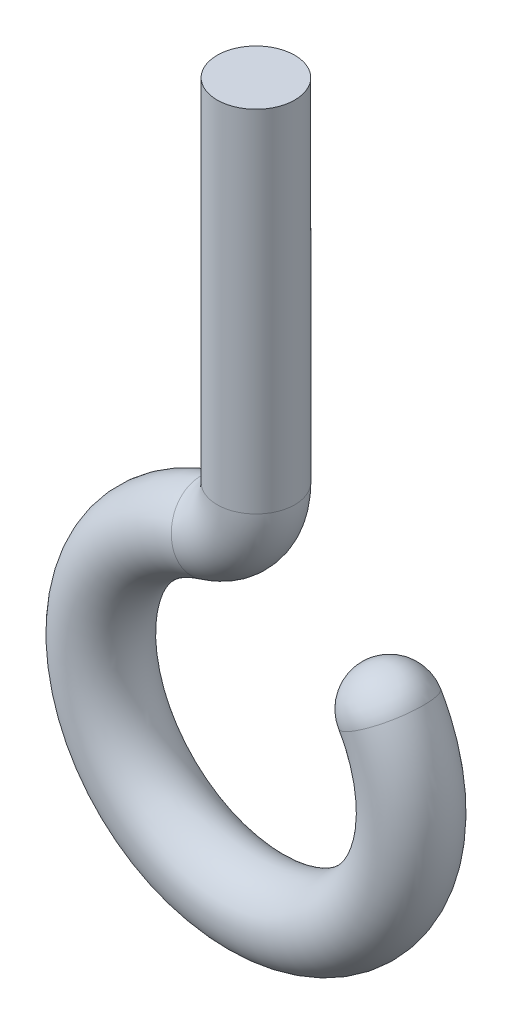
SolidWorks part; units mm, degrees
ref_plane "Front Plane" through (0, 0, 0) normal (0, 0, 1) x (1, 0, 0)
ref_plane "Top Plane" through (0, 0, 0) normal (0, 1, 0) x (1, 0, 0)
ref_plane "Right Plane" through (0, 0, 0) normal (1, 0, 0) x (0, 0, -1)
body saved out of another part "Stock-Mobile-1"
sketch "Sketch1" plane through (0, 0, 0) normal (0, 0, 1) x (1, 0, 0)
  circle A0 centre (0, -49.25) radius 0.5
  arc A1 (-1.0714, -42.4063) -> (3.2304, -44.0955) centre (0, -46) ccw construction
  dimension "D1" = 1
